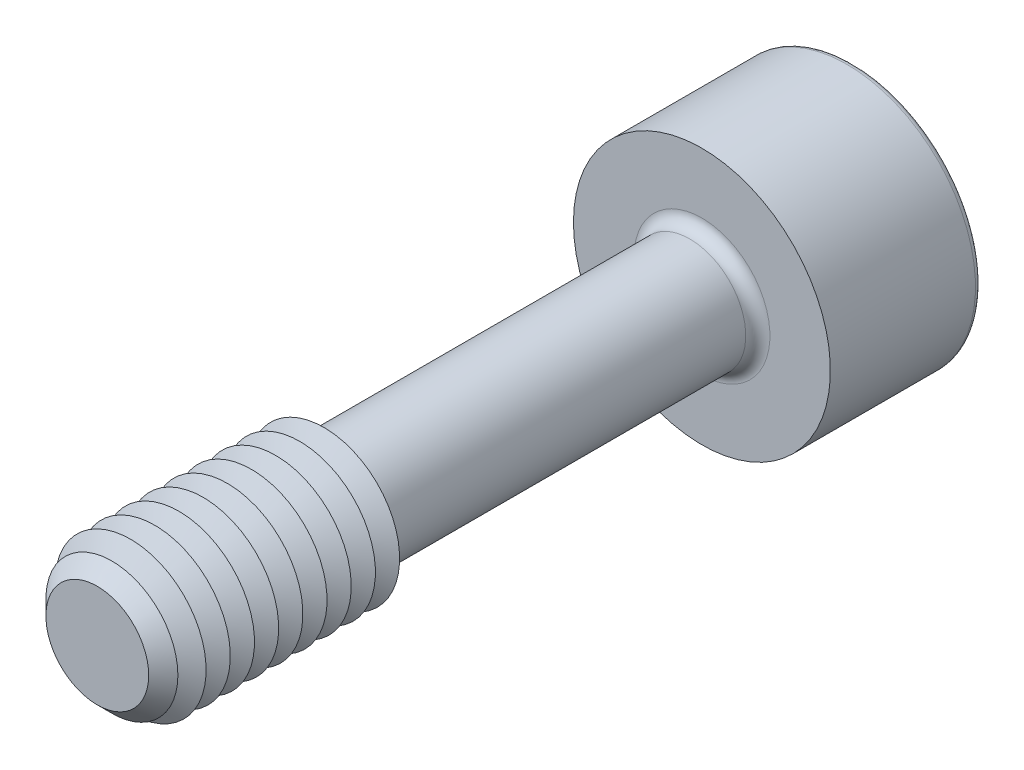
SolidWorks part; units mm, degrees
ref_plane "Front Plane" through (0, 0, 0) normal (0, 0, 1) x (1, 0, 0)
ref_plane "Top Plane" through (0, 0, 0) normal (0, 1, 0) x (1, 0, 0)
ref_plane "Right Plane" through (0, 0, 0) normal (1, 0, 0) x (0, 0, -1)
sketch "Sketch1" plane through (0, 0, 0) normal (0, 0, 1) x (1, 0, 0)
  circle A0 centre (0, 0) radius 1.85
  dimension "D1" = 3.7
extrude "Extrude1" add sketch "Sketch1" along normal mid plane 20
sketch "Sketch2" plane through (0, 0, 0) normal (1, 0, 0) x (0, 0, -1)
  line L0 (-10, 0) -> (-10, 2.5)
  line L1 (-10, 1.85) -> (-10, -1.85) construction
  line L2 (-10, 2.5) -> (-2.5, 2.5)
  line L3 (-2.5, 2.5) -> (-2.1247, 1.85)
  line L4 (10, 1.85) -> (-10, 1.85) construction
  line L5 (-2.1247, 1.85) -> (-2.1247, 0)
  line L6 (-2.1247, 0) -> (-10, 0)
  dimension "D1" = 2.5
  dimension "D2" = 120
  dimension "D3" = 7.5
revolve "Revolve1" add sketch "Sketch2" angle 360 about L6
chamfer "Chamfer1" distance 0.8 angle 45 1 edges at (0, 2.5, 10)
sketch "Sketch3" plane through (0, 0, -10) normal (0, 0, -1) x (-1, 0, 0)
  circle A0 centre (0, 0) radius 4.25
  dimension "D1" = 8.5
extrude "Extrude2" add sketch "Sketch3" along normal blind 5
sketch "Sketch4" plane through (-13.7, 0, -15) normal (0, 0, 1) x (1, 0, 0)
  line L2 (12.5453, -2) -> (14.8547, -2)
  line L3 (14.8547, -2) -> (16.0094, 0)
  line L4 (16.0094, 0) -> (14.8547, 2)
  line L6 (14.8547, 2) -> (12.5453, 2)
  line L7 (12.5453, 2) -> (11.3906, 0)
  line L8 (11.3906, 0) -> (12.5453, -2)
  circle A0 centre (13.7, 0) radius 2 construction
  dimension "D1" = 4
extrude "Extrude3" cut sketch "Sketch4" along normal blind 4
fillet "Fillet1" radius 0.4 1 edges at (-1.85, 0, -10)
fillet "Fillet2" radius 0.2 1 edges at (-4.25, 0, -15)
sketch "Sketch5" plane through (0, 0, 0) normal (1, 0, 0) x (0, 0, -1)
  line L0 (11, 0) -> (11, -2)
  line L1 (11, -2) -> (9.8453, 0)
  line L2 (9.8453, 0) -> (11, 0)
  dimension "D1" = 30
revolve "Cut-Revolve1" cut sketch "Sketch5" angle 360 about L2
sketch "Sketch6" plane through (0, 0, 0) normal (1, 0, 0) x (0, 0, -1)
  line L0 (1.332, 0) -> (-13.289, 0) construction
sketch "Sketch7" plane through (0, 0, 0) normal (1, 0, 0) x (0, 0, -1)
  line L0 (-2.5, 2.5) -> (-2.9, 1.8072)
  line L1 (-2.9, 1.8072) -> (-3.3, 2.5)
  line L2 (-2.5, 2.5) -> (-9.2, 2.5) construction
  line L3 (-3.3, 2.5) -> (-2.5, 2.5)
  dimension "D1" = 0.8
revolve "Cut-Revolve2" cut sketch "Sketch7" angle 360 about L0
pattern_linear "LPattern1" count 9 spacing 0.8 along (0, 0, 1) of "Cut-Revolve2"
